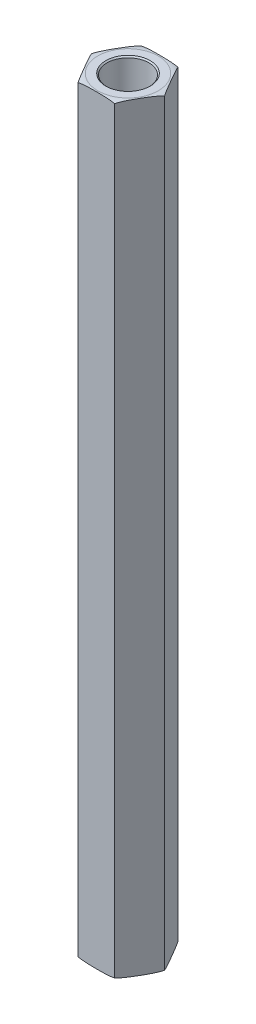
SolidWorks part; units mm, degrees
ref_plane "Front Plane" through (0, 0, 0) normal (0, 0, 1) x (1, 0, 0)
ref_plane "Top Plane" through (0, 0, 0) normal (0, 1, 0) x (1, 0, 0)
ref_plane "Right Plane" through (0, 0, 0) normal (1, 0, 0) x (0, 0, -1)
imported_body "Imported3"
hole_wizard "M3.5 Clearance Hole1" positions "Sketch2" profile "Sketch1" hole size "M3.5" standard "ANSI Metric"
sketch "Sketch2" plane through (0, -38.1, 0) normal (0, -1, 0) x (-1, 0, 0)
  point P0 (0, 0)
sketch "Sketch1" plane through (0, -38.1, 0) normal (1, 0, 0) x (0, 0, -1)
  line L0 (0, 0) -> (0, 12.7)
  line L1 (0, 12.7) -> (2.0955, 12.7)
  line L2 (2.0955, 12.7) -> (2.0955, 0)
  line L5 (2.0955, 0) -> (0, 0)
  line L10 (0, 12.7) -> (-2.0955, 12.7) construction
  line L11 (0, -6.35) -> (0, 107.95) construction
  dimension "Hole Dia." = 4.191
  dimension "Hole Depth" = 12.7
  dimension "Drill Angle" = 180
hole_wizard "M3.5 Clearance Hole2" positions "Sketch4" profile "Sketch3" hole size "M3.5" standard "ANSI Metric"
sketch "Sketch4" plane through (0, 38.1, 0) normal (0, 1, 0) x (1, 0, 0)
  point P0 (0, 0)
sketch "Sketch3" plane through (0, 38.1, 0) normal (1, 0, 0) x (0, 0, 1)
  line L0 (0, 0) -> (0, 12.7)
  line L1 (0, 12.7) -> (2.0955, 12.7)
  line L2 (2.0955, 12.7) -> (2.0955, 0)
  line L5 (2.0955, 0) -> (0, 0)
  line L10 (0, 12.7) -> (-2.0955, 12.7) construction
  line L11 (0, -6.35) -> (0, 107.95) construction
  dimension "Hole Dia." = 4.191
  dimension "Hole Depth" = 12.7
  dimension "Drill Angle" = 180
chamfer "Chamfer1" distance 0.127 angle 45 2 edges at (0, 38.1, 2.0955) (0, -38.1, -2.0955)
